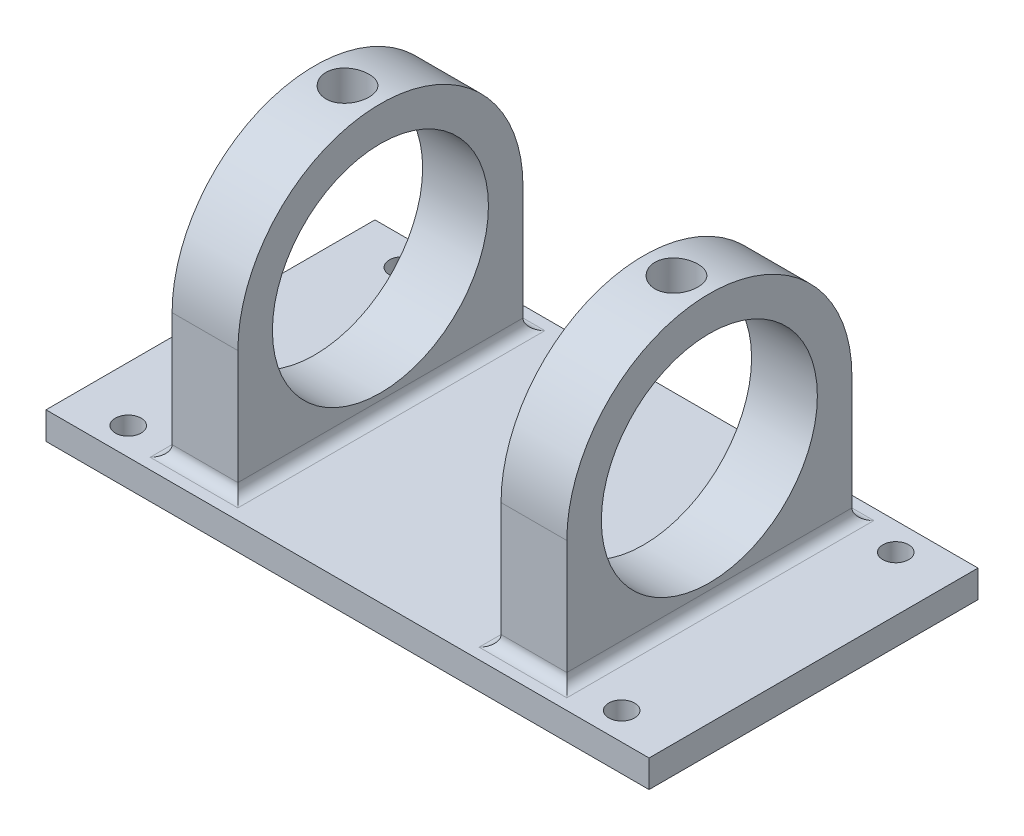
SolidWorks part; units mm, degrees
ref_plane "Front Plane" through (0, 0, 0) normal (0, 0, 1) x (1, 0, 0)
ref_plane "Top Plane" through (0, 0, 0) normal (0, 1, 0) x (1, 0, 0)
ref_plane "Right Plane" through (0, 0, 0) normal (1, 0, 0) x (0, 0, -1)
sketch "Sketch1" plane through (0, 0, 0) normal (0, 1, 0) x (1, 0, 0)
  line L1 (-34.925, -19.05) -> (34.925, -19.05)
  line L2 (-34.925, -19.05) -> (-34.925, 19.05)
  line L3 (-34.925, 19.05) -> (34.925, 19.05)
  line L4 (34.925, -19.05) -> (34.925, 19.05)
  line L5 (-34.925, -19.05) -> (34.925, 19.05) construction
  line L6 (-34.925, 19.05) -> (34.925, -19.05) construction
  point P0 (0, 0)
  dimension "D1" = 69.85
  dimension "D2" = 38.1
extrude "Boss-Extrude1" add sketch "Sketch1" along normal blind 3.175
ref_plane "Plane1" through (-19.05, 0, 0) normal (1, 0, 0) x (0, 0, -1)
sketch "Sketch8" plane through (-19.05, 0, 0) normal (1, 0, 0) x (0, 0, -1)
  line L0 (-19.05, 3.175) -> (19.05, 3.175) construction
  line L3 (-16.51, 17.6835) -> (-16.51, 3.175)
  line L4 (-16.51, 3.175) -> (16.51, 3.175)
  line L5 (16.51, 17.6835) -> (16.51, 3.175)
  circle A0 centre (0, 17.6835) radius 12.5095
  arc A2 (16.51, 17.6835) -> (-16.51, 17.6835) centre (0, 17.6835) ccw
  point P4 (0, 3.175)
  dimension "D2" = 25.019
  dimension "D1" = 14.5085
extrude "Boss-Extrude2" add sketch "Sketch8" along normal mid plane 7.62
fillet "Fillet1" radius 1.27 4 edges at (-19.05, 3.175, 16.51) (-15.24, 3.175, 0) (-19.05, 3.175, -16.51) (-22.86, 3.175, 0)
ref_plane "Plane2" through (0, 34.1935, 0) normal (0, 1, 0) x (1, 0, 0)
sketch "Sketch14" plane through (0, 34.1935, 0) normal (0, 1, 0) x (1, 0, 0)
  line L0 (-15.24, 0) -> (-22.86, 0)
  line L1 (-15.24, -16.51) -> (-15.24, 16.51) construction
  line L2 (-22.86, 16.51) -> (-22.86, -16.51) construction
  circle A0 centre (-19.05, 0) radius 2.49
  dimension "D1" = 4.98
extrude "Cut-Extrude1" cut sketch "Sketch14" against normal blind 4.7625 contours L0 A0 | L0 A0
mirror "Mirror1" about plane through (0, 0, 0) normal (1, 0, 0) of "Cut-Extrude1", "Fillet1", "Boss-Extrude2"
sketch "Sketch15" plane through (0, 3.175, 0) normal (0, 1, 0) x (1, 0, 0)
  line L1 (-28.575, -15.875) -> (28.575, -15.875)
  line L2 (-28.575, -15.875) -> (-28.575, 15.875)
  line L3 (-28.575, 15.875) -> (28.575, 15.875)
  line L4 (28.575, -15.875) -> (28.575, 15.875)
  line L5 (-28.575, -15.875) -> (28.575, 15.875) construction
  line L6 (-28.575, 15.875) -> (28.575, -15.875) construction
  line L7 (34.925, -19.05) -> (34.925, 19.05) construction
  line L8 (34.925, 19.05) -> (-34.925, 19.05) construction
  point P1 (0, 0)
  dimension "D1" = 6.35
  dimension "D2" = 3.175
hole_wizard "Ø3.0mm Dowel Hole2" positions "Sketch15" profile "Sketch16" hole size "Ø3.0" standard "ANSI Metric"
sketch "Sketch16" plane through (28.575, 3.175, 15.875) normal (1, 0, 0) x (0, 0, 1)
  line L0 (0, 0) -> (0, 3.175)
  line L1 (0, 3.175) -> (1.5, 3.175)
  line L2 (1.5, 3.175) -> (1.5, 0)
  line L5 (1.5, 0) -> (0, 0)
  line L11 (0, -6.35) -> (0, 107.95) construction
  dimension "Thru Hole Dia." = 3
  dimension "Thru Hole Depth" = 3.175
